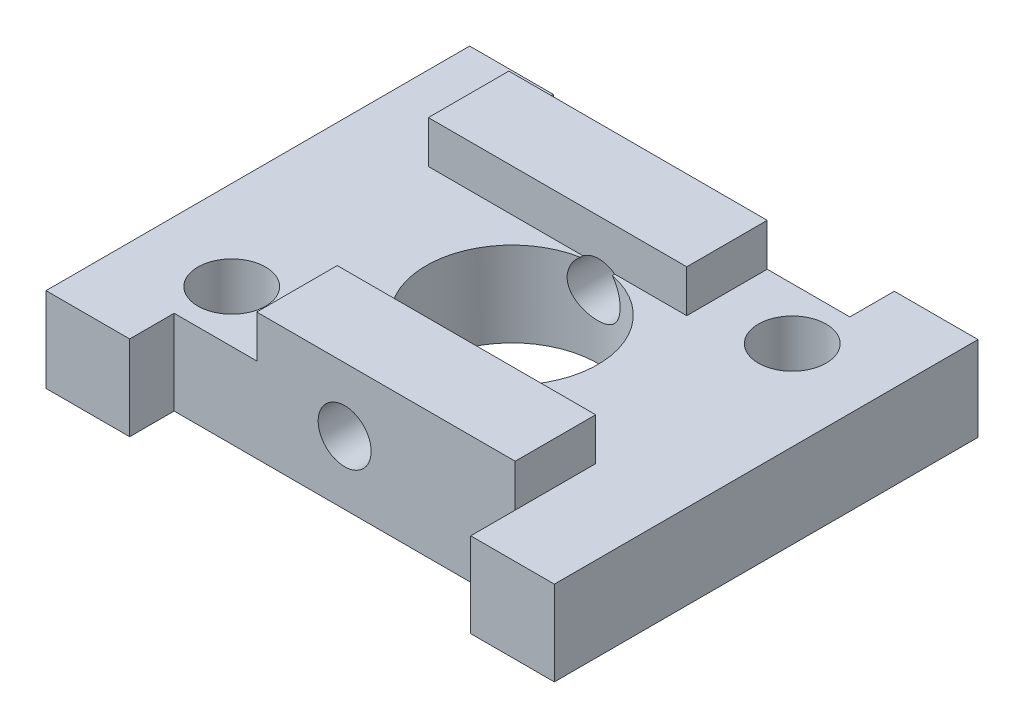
SolidWorks part; units mm, degrees
ref_plane "Front Plane" through (0, 0, 0) normal (0, 0, 1) x (1, 0, 0)
ref_plane "Top Plane" through (0, 0, 0) normal (0, 1, 0) x (1, 0, 0)
ref_plane "Right Plane" through (0, 0, 0) normal (1, 0, 0) x (0, 0, -1)
sketch "Sketch1" plane through (0, 0, 0) normal (0, 1, 0) x (1, 0, 0)
  line L1 (-6, 5) -> (6, 5)
  line L2 (-6, 5) -> (-6, -5)
  line L3 (-6, -5) -> (6, -5)
  line L4 (6, 5) -> (6, -5)
  line L5 (-6, 5) -> (6, -5) construction
  line L6 (-6, -5) -> (6, 5) construction
  circle A0 centre (0, 0) radius 2.025
  point P0 (0, 0)
  dimension "D1" = 4.05
  dimension "D2" = 10
  dimension "D3" = 12
extrude "Boss-Extrude1" add sketch "Sketch1" along normal blind 2
sketch "Sketch2" plane through (0, 2, 0) normal (0, 1, 0) x (1, 0, 0)
  line L0 (6, 5) -> (-6, 5) construction
  line L1 (-4.025, 5) -> (4.025, 5)
  line L2 (-4.025, 5) -> (-4.025, 3.95)
  line L3 (-4.025, 3.95) -> (4.025, 3.95)
  line L4 (4.025, 5) -> (4.025, 3.95)
  line L5 (-6, -5) -> (6, -5) construction
  line L6 (-4.025, -5) -> (4.025, -5)
  line L7 (-4.025, -5) -> (-4.025, -3.95)
  line L8 (-4.025, -3.95) -> (4.025, -3.95)
  line L9 (4.025, -5) -> (4.025, -3.95)
  line L10 (0, -1.1) -> (0, 1.1) construction
  line L11 (-3.891, -2.7245) -> (3.891, 2.7245) construction
  line L15 (-1.1, 0) -> (1.1, 0) construction
  circle A0 centre (3.891, 2.7245) radius 0.8
  circle A1 centre (-3.891, -2.7245) radius 0.8
  point P12 (0, -5)
  point P15 (0, 5)
  point P18 (0, 0)
  point P22 (4.691, 2.7245)
  dimension "D3" = 1.6
  dimension "D1" = 7.9
  dimension "D2" = 8.05
  dimension "D4" = 9.5
  dimension "D5" = 35
extrude "Cut-Extrude1" cut sketch "Sketch2" against normal blind 2
sketch "Sketch3" plane through (0, 2, 0) normal (0, 1, 0) x (1, 0, 0)
  line L1 (-4.025, 3.95) -> (2.075, 3.95)
  line L2 (-4.025, 3.95) -> (-4.025, 2.05)
  line L3 (-4.025, 2.05) -> (2.075, 2.05)
  line L4 (2.075, 3.95) -> (2.075, 2.05)
  line L5 (4.025, -3.95) -> (-2.075, -3.95)
  line L6 (4.025, -3.95) -> (4.025, -2.05)
  line L7 (4.025, -2.05) -> (-2.075, -2.05)
  line L8 (-2.075, -3.95) -> (-2.075, -2.05)
  dimension "D1" = 6.1
  dimension "D2" = 1.9
extrude "Boss-Extrude2" add sketch "Sketch3" along normal blind 1
hole_wizard "M1.6 Tapped Hole1" positions "Sketch4" profile "Sketch5" tap size "M1.6" standard "ISO"
sketch "Sketch4" plane through (0, 0, 3.95) normal (0, 0, 1) x (1, 0, 0)
  line L0 (0, -1.65) -> (0, 1.65) construction
  line L1 (5.5, 0) -> (-5.5, 0) construction
  point P0 (0, 1.5)
  dimension "D1" = 1.5
sketch "Sketch5" plane through (0, 1.5, 3.95) normal (1, 0, 0) x (0, -1, 0)
  line L0 (0, 0) -> (0, 1.925)
  line L1 (0, 1.925) -> (0.625, 1.925)
  line L2 (0.625, 1.925) -> (0.625, 0)
  line L5 (0.625, 0) -> (0, 0)
  line L11 (0, -6.35) -> (0, 107.95) construction
  dimension "Thru Tap Drill Dia." = 1.25
  dimension "Thru Tap Drill Depth" = 1.925
hole_wizard "M1.6 Tapped Hole2" positions "Sketch6" profile "Sketch7" tap size "M1.6" standard "ISO"
sketch "Sketch6" plane through (0, 0, -3.95) normal (0, 0, -1) x (-1, 0, 0)
  point P0 (0, 1.5)
sketch "Sketch7" plane through (0, 1.5, -3.95) normal (1, 0, 0) x (0, 1, 0)
  line L0 (0, 0) -> (0, 1.925)
  line L1 (0, 1.925) -> (0.625, 1.925)
  line L2 (0.625, 1.925) -> (0.625, 0)
  line L5 (0.625, 0) -> (0, 0)
  line L11 (0, -6.35) -> (0, 107.95) construction
  dimension "Thru Tap Drill Dia." = 1.25
  dimension "Thru Tap Drill Depth" = 1.925
